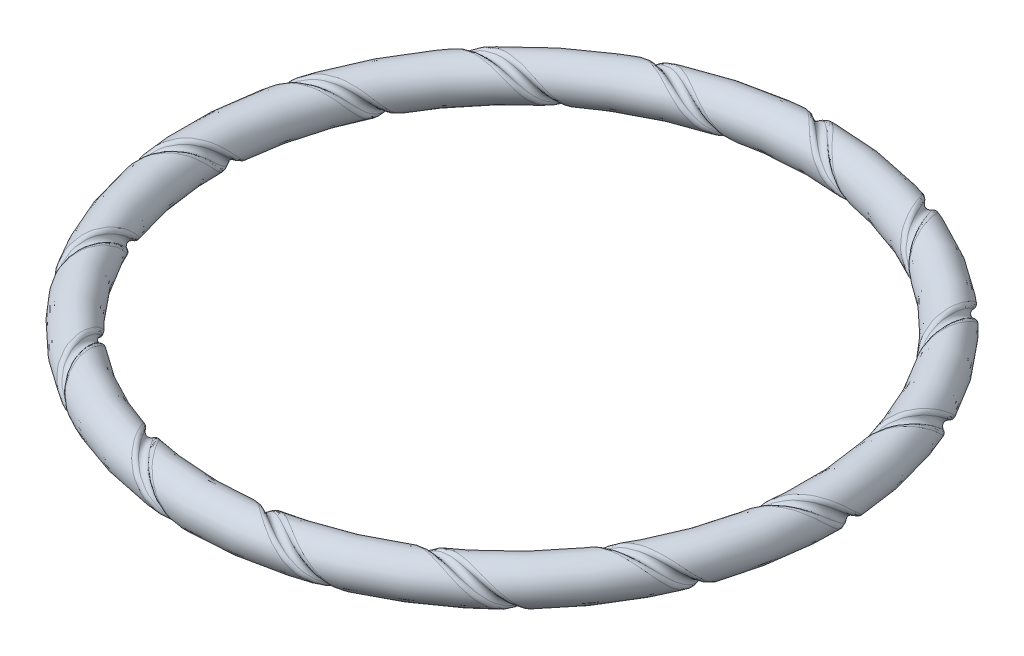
SolidWorks part; units mm, degrees
ref_plane "Front Plane" through (0, 0, 0) normal (0, 0, 1) x (1, 0, 0)
ref_plane "Top Plane" through (0, 0, 0) normal (0, 1, 0) x (1, 0, 0)
ref_plane "Right Plane" through (0, 0, 0) normal (1, 0, 0) x (0, 0, -1)
sketch "Sketch1" plane through (0, 0, 0) normal (0, 0, 1) x (1, 0, 0)
  line L0 (0, 0) -> (0, 28.398) construction
  circle A0 centre (23.8125, 0) radius 1.5875
  dimension "D1" = 3.175
  dimension "D2" = 50.8
revolve "Revolve1" add sketch "Sketch1" angle 360 about L0
sketch "Profile" plane through (0, 0, 0) normal (0, 0, 1) x (1, 0, 0)
  circle A0 centre (23.8125, 0) radius 1.8415 construction
  circle A1 centre (25.654, 0) radius 0.635
  dimension "D1" = 3.683
  dimension "D2" = 1.27
sketch "Path" plane through (0, 0, 0) normal (0, 1, 0) x (1, 0, 0)
  circle A0 centre (0, 0) radius 23.8125
sweep "Cut-Sweep1" cut profiles "Profile" path "Path" parameters "D4"=5400
fillet "Fillet1" radius 0.3302 2 edges at (-22.2191, -0.0644, -0.5672) (-22.6038, -1.0372, -0.5576)
